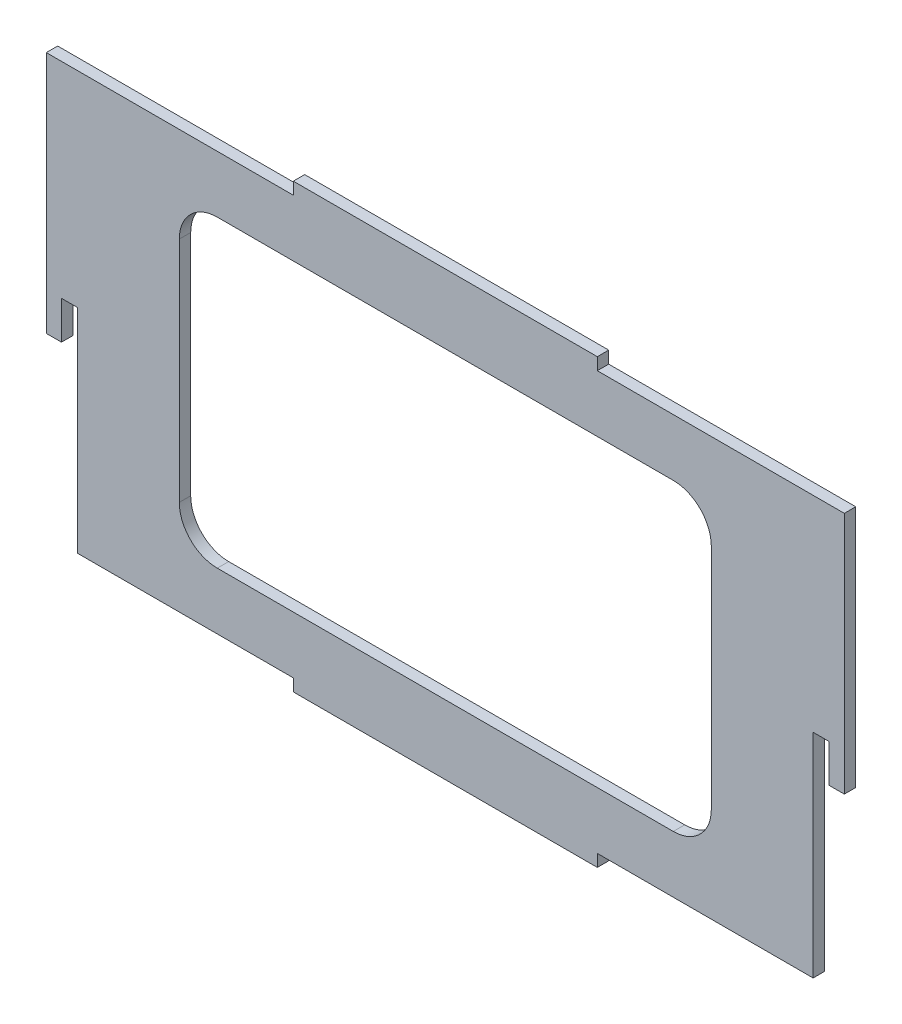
SolidWorks part; units mm, degrees
ref_plane "Plan de face" through (0, 0, 0) normal (0, 0, 1) x (1, 0, 0)
ref_plane "Plan de dessus" through (0, 0, 0) normal (0, 1, 0) x (1, 0, 0)
ref_plane "Plan de droite" through (0, 0, 0) normal (1, 0, 0) x (0, 0, -1)
sketch "Esquisse1" plane through (0, 0, 0) normal (0, 0, 1) x (1, 0, 0)
  line L0 (-52.5, 27.5) -> (52.5, -27.5) construction
  line L2 (-52.5, 27.5) -> (-52.5, -27.5)
  line L3 (-52.5, -27.5) -> (-50.5, -27.5)
  line L4 (52.5, 27.5) -> (52.5, -27.5)
  line L5 (0, 0) -> (0, -53.5236) construction
  line L7 (-20, -27.5) -> (-20, -29.1)
  line L8 (-20, -29.1) -> (20, -29.1)
  line L9 (20, -27.5) -> (20, -29.1)
  line L10 (20, -27.5) -> (48.4, -27.5)
  line L19 (-52.5, 27.5) -> (-20, 27.5)
  line L21 (0, 0) -> (24.5194, 0) construction
  line L22 (20, 27.5) -> (20, 29.1)
  line L23 (-20, 29.1) -> (20, 29.1)
  line L24 (-20, 27.5) -> (-20, 29.1)
  line L25 (20, 27.5) -> (52.5, 27.5)
  line L26 (50.5, 0.5) -> (48.4, 0.5)
  line L28 (-50.5, -27.5) -> (-50.5, 0.5)
  line L29 (-50.5, 0.5) -> (-48.4, 0.5)
  line L30 (-48.4, -27.5) -> (-48.4, 0.5)
  line L31 (48.4, -27.5) -> (48.4, 0.5)
  line L32 (50.5, -27.5) -> (50.5, 0.5)
  line L33 (-48.4, -27.5) -> (-20, -27.5)
  line L34 (50.5, -27.5) -> (52.5, -27.5)
  line L36 (-30, 20) -> (30, 20)
  line L37 (-35, 15) -> (-35, -15)
  line L38 (-30, -20) -> (30, -20)
  line L39 (35, 15) -> (35, -15)
  arc A0 (-35, -15) -> (-30, -20) centre (-30, -15) ccw
  arc A1 (30, -20) -> (35, -15) centre (30, -15) ccw
  arc A2 (30, 20) -> (35, 15) centre (30, 15) cw
  arc A3 (-30, 20) -> (-35, 15) centre (-30, 15) ccw
  dimension "D9" = 5
  dimension "D1" = 55
  dimension "D2" = 105
  dimension "D3" = 40
  dimension "D4" = 1.6
  dimension "D5" = 28
  dimension "D6" = 2.1
  dimension "D7" = 2
  dimension "D8" = 70
  dimension "D10" = 40
extrude "Boss.-Extru.1" add sketch "Esquisse1" along normal blind 1.5
sketch "Esquisse2" plane through (0, 0, 0) normal (0, 0, 1) x (1, 0, 0)
  line L0 (-50.5, -27.5) -> (-50.5, 0.5) construction
  line L1 (-52.5, -27.5) -> (-50.5, -27.5)
  line L2 (-52.5, -27.5) -> (-52.5, -4.5)
  line L3 (-52.5, -4.5) -> (-50.5, -4.5)
  line L4 (-50.5, -27.5) -> (-50.5, -4.5)
  line L5 (-50.5, 0.5) -> (-48.4, 0.5) construction
  line L6 (0, 0) -> (0, -11.1522) construction
  line L7 (50.5, -27.5) -> (50.5, -4.5)
  line L8 (52.5, -4.5) -> (50.5, -4.5)
  line L9 (52.5, -27.5) -> (52.5, -4.5)
  line L10 (52.5, -27.5) -> (50.5, -27.5)
  dimension "D1" = 5
extrude "Enlèv. mat.-Extru.1" cut sketch "Esquisse2" along normal blind 10
